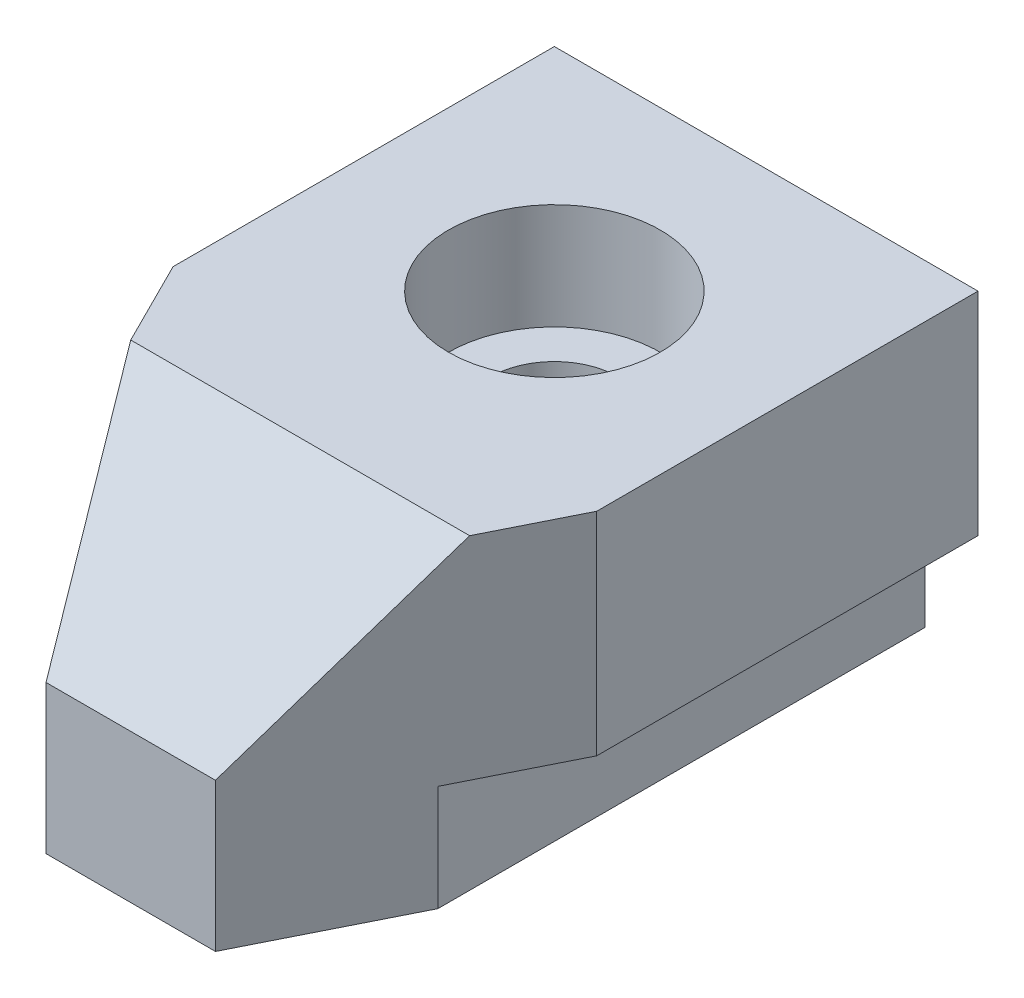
SolidWorks part; units mm, degrees
ref_plane "前视基准面" through (0, 0, 0) normal (0, 0, 1) x (1, 0, 0)
ref_plane "上视基准面" through (0, 0, 0) normal (0, 1, 0) x (1, 0, 0)
ref_plane "右视基准面" through (0, 0, 0) normal (1, 0, 0) x (0, 0, -1)
sketch "草图1" plane through (0, 0, 0) normal (1, 0, 0) x (0, 0, -1)
  line L1 (-15, -7.5) -> (15, -7.5)
  line L2 (-15, -7.5) -> (-15, 7.5)
  line L3 (-15, 7.5) -> (15, 7.5)
  line L4 (15, -7.5) -> (15, 7.5)
  line L5 (-15, -7.5) -> (15, 7.5) construction
  line L6 (-15, 7.5) -> (15, -7.5) construction
  point P0 (0, 0)
  dimension "D1" = 30
  dimension "D2" = 15
extrude "凸台-拉伸1" add sketch "草图1" along normal blind 20
ref_plane "基准面1" through (10, 0, 0) normal (1, 0, 0) x (0, 0, -1)
sketch "草图3" plane through (10, 0, 0) normal (1, 0, 0) x (0, 0, -1)
  line L0 (5, 10.1511) -> (5, -11.1683) construction
  line L1 (5, 7.5232) -> (0, 7.5)
  line L2 (15, 7.5) -> (-15, 7.5) construction
  line L3 (0, 7.5) -> (0, 2.5)
  line L4 (0, 2.5) -> (2, 2.5)
  line L5 (2, 2.5) -> (2, -7.5)
  line L6 (-15, -7.5) -> (15, -7.5) construction
  line L7 (2, -7.5) -> (5, -7.5)
  line L8 (5, -7.5) -> (5, 7.5232)
  dimension "D1" = 5
  dimension "D2" = 3
  dimension "D3" = 5
  dimension "D4" = 10
revolve "切除-旋转1" cut sketch "草图3" angle 360 about L0
sketch "草图4" plane through (20, 0, 0) normal (1, 0, 0) x (0, 0, -1)
  line L0 (-15, 7.5) -> (-15, -7.5) construction
  line L1 (-15, 7.5) -> (-15, -0.5)
  line L2 (-15, -0.5) -> (-7, 7.5)
  line L3 (15, 7.5) -> (-15, 7.5) construction
  line L4 (-7, 7.5) -> (-15, 7.5)
  dimension "D1" = 8
  dimension "D2" = 8
extrude "切除-拉伸1" cut sketch "草图4" against normal blind 20
sketch "草图5" plane through (0, 0, 0) normal (0, 1, 0) x (1, 0, 0)
  line L0 (10, -1.9696) -> (10, -17.0285) construction
  line L1 (0, -3) -> (6, -15)
  line L2 (0, 15) -> (0, -7) construction
  line L3 (0, -15) -> (20, -15) construction
  line L4 (6, -15) -> (0, -15)
  line L5 (0, -15) -> (0, -3)
  line L6 (14, -15) -> (20, -15)
  line L7 (20, -15) -> (20, -3)
  line L8 (20, -3) -> (14, -15)
  dimension "D1" = 6
  dimension "D2" = 12
extrude "切除-拉伸2" cut sketch "草图5" against normal mid plane 20
sketch "草图6" plane through (0, 0, 0) normal (0, 0, 1) x (1, 0, 0)
  line L0 (10, -9.2902) -> (10, 2.546) construction
  line L1 (0, -2.5) -> (2.5, -2.5)
  line L2 (0, -7.5) -> (0, 7.5) construction
  line L3 (2.5, -2.5) -> (2.5, -7.5)
  line L4 (6, -7.5) -> (0, -7.5) construction
  line L5 (2.5, -7.5) -> (0, -7.5)
  line L6 (0, -7.5) -> (0, -2.5)
  line L7 (17.5, -7.5) -> (20, -7.5)
  line L8 (20, -7.5) -> (20, -2.5)
  line L9 (17.5, -2.5) -> (17.5, -7.5)
  line L10 (20, -2.5) -> (17.5, -2.5)
  dimension "D1" = 5
  dimension "D2" = 2.5
extrude "切除-拉伸3" cut sketch "草图6" against normal mid plane 30
